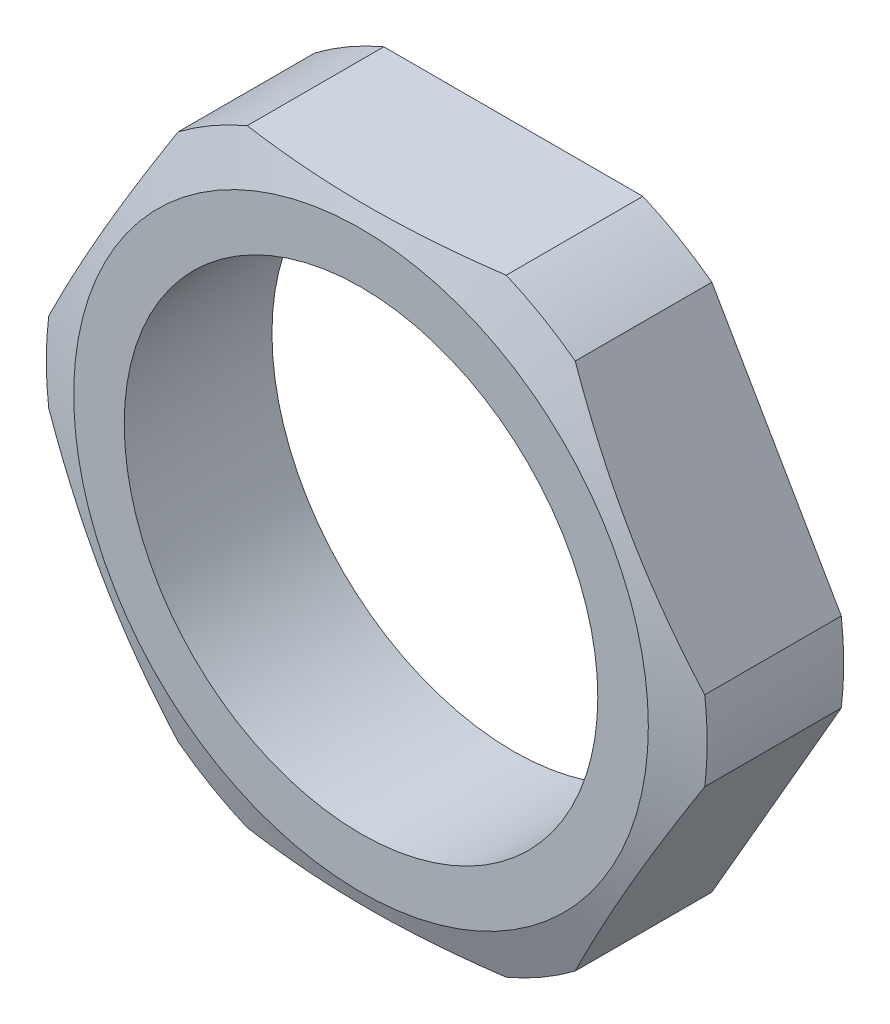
SolidWorks part; units mm, degrees
ref_plane "Front" through (0, 0, 0) normal (0, 0, 1) x (1, 0, 0)
ref_plane "Top" through (0, 0, 0) normal (0, 1, 0) x (1, 0, 0)
ref_plane "Right" through (0, 0, 0) normal (1, 0, 0) x (0, 0, -1)
sketch "Sketch1" plane through (0, 0, 0) normal (0, 0, 1) x (1, 0, 0)
  line L1 (15.5152, 0) -> (7.7576, 13.4366)
  line L2 (7.7576, 13.4366) -> (-7.7576, 13.4366)
  line L3 (-7.7576, 13.4366) -> (-15.5152, 0)
  line L4 (-15.5152, 0) -> (-7.7576, -13.4366)
  line L5 (-7.7576, -13.4366) -> (7.7576, -13.4366)
  line L6 (7.7576, -13.4366) -> (15.5152, 0)
  circle A0 centre (0, 0) radius 13.4366 construction
  dimension "D1" = 26.8732
extrude "Base-Extrude" add sketch "Sketch1" along normal mid plane 6.731
hole_wizard "1/2 NPT Tapped Hole1" positions "Sketch3" profile "Sketch2" size "1/2" standard "Ansi Inch"
sketch "Sketch3" plane through (0, 0, -3.3655) normal (0, 0, -1) x (-1, 0, 0)
  point P0 (0, 0)
sketch "Sketch2" plane through (0, 0, -3.3655) normal (1, 0, 0) x (0, 1, 0)
  line L0 (0, 0) -> (0, 28.0036)
  line L1 (8.9281, 22.639) -> (0, 28.0036)
  line L2 (-8.9281, 22.639) -> (0, 28.0036) construction
  line L3 (8.9281, 22.639) -> (8.9281, 13.5712)
  line L4 (8.9281, 13.5712) -> (10.2617, 13.5712)
  line L5 (10.2617, 13.5712) -> (10.668, 0)
  line L6 (-10.2617, 13.5712) -> (-10.668, 0) construction
  line L7 (10.668, 0) -> (0, 0)
  line L8 (0, -6.35) -> (0, 107.95) construction
  line L11 (-8.9281, 13.5712) -> (-10.2617, 13.5712) construction
  dimension "Tap Drill Dia." = 17.8562
  dimension "Tap Drill Depth" = 22.639
  dimension "Thread Dia." = 21.336
  dimension "Thread Angle" = 3.43
  dimension "Thread Depth" = 13.5712
  dimension "Drill Angle" = 118
sketch "Sketch4" plane through (0, 0, 3.3655) normal (0, 0, 1) x (1, 0, 0)
  circle A0 centre (0, 0) radius 12.7
  dimension "D1" = 25.4
extrude "Cut-Extrude1" cut sketch "Sketch4" against normal blind 13.335 draft 70 flip side to cut
mirror "Mirror1" about plane through (0, 0, 0) normal (0, 0, 1)
sketch "Sketch5" plane through (0, 0, 3.3655) normal (0, 0, 1) x (1, 0, 0)
  circle A0 centre (0, 0) radius 14.605
  dimension "D1" = 29.21
extrude "Cut-Extrude2" cut sketch "Sketch5" against normal through all flip side to cut
